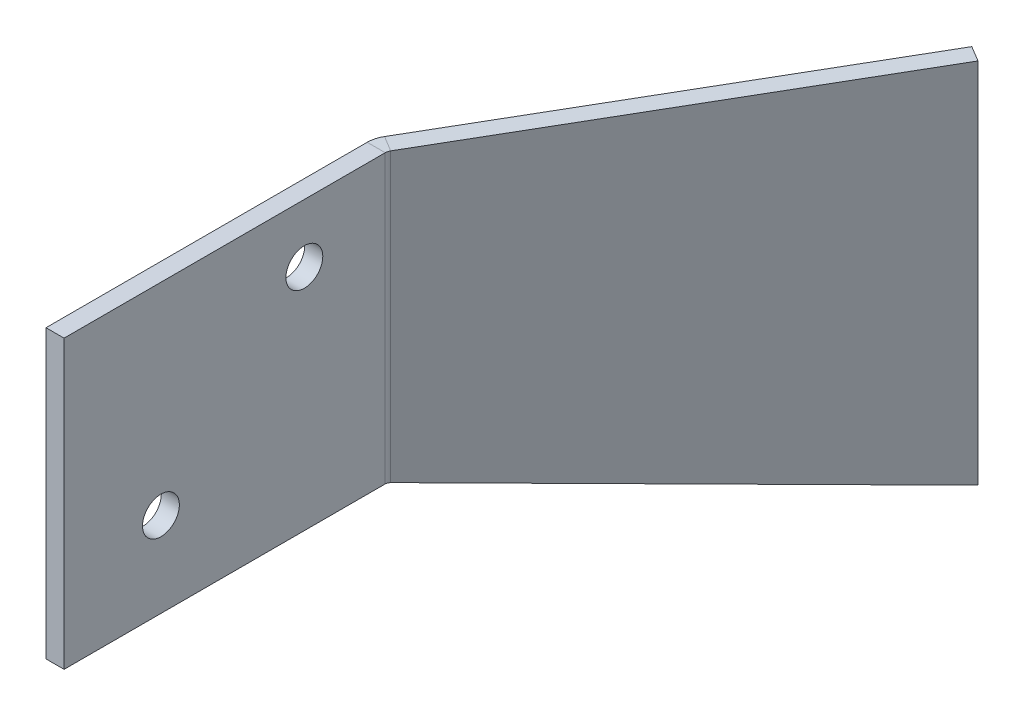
SolidWorks part; units mm, degrees
other "<rail>-<Cut-Extrude1>"
ref_plane "Front Plane" through (0, 0, 0) normal (0, 0, 1) x (1, 0, 0)
ref_plane "Top Plane" through (0, 0, 0) normal (0, 1, 0) x (1, 0, 0)
ref_plane "Right Plane" through (0, 0, 0) normal (1, 0, 0) x (0, 0, -1)
mirrored part "rail_Mirrored"
